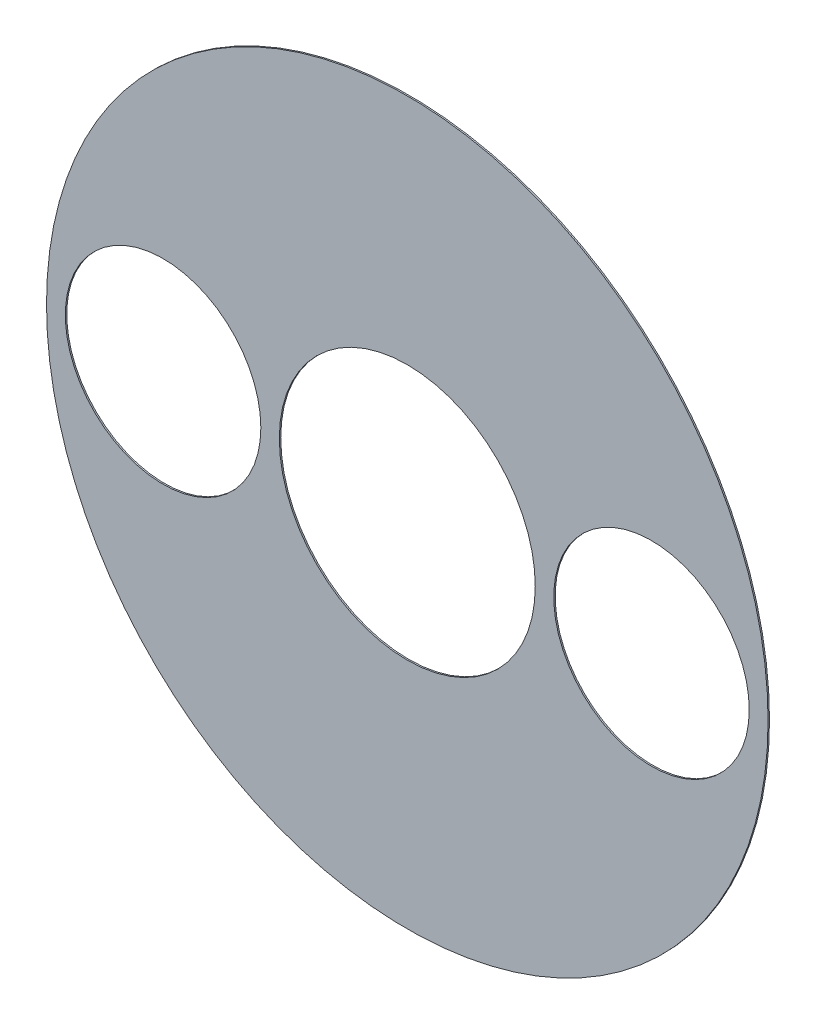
SolidWorks part; units mm, degrees
ref_plane "Front Plane" through (0, 0, 0) normal (0, 0, 1) x (1, 0, 0)
ref_plane "Top Plane" through (0, 0, 0) normal (0, 1, 0) x (1, 0, 0)
ref_plane "Right Plane" through (0, 0, 0) normal (1, 0, 0) x (0, 0, -1)
sketch "Sketch1" plane through (0, 0, 0) normal (0, 0, 1) x (1, 0, 0)
  circle A0 centre (0, 0) radius 507.5
  dimension "Plate dia" = 1015
base flange "Base-Flange1" sketch "Sketch1" thickness 2 reverse thickness direction no parameters "D1"=1
sketch "Sketch6" plane through (0, 0, 0) normal (0, 0, 1) x (1, 0, 0)
  circle A0 centre (0, 0) radius 180
  circle A1 centre (-343.5, 0) radius 137.5
  circle A2 centre (343.5, 0) radius 137.5
  dimension "BH 1" = 360
  dimension "SH 1" = 275
  dimension "SH 2" = 275
  dimension "Hole gap " = 687
  dimension "Hole gap 2" = 343.5
extrude "Cut-Extrude5" cut sketch "Sketch6" against normal blind 10 contours A2 | A0 | A1
sketch "Bend-Lines1" [suppressed] plane through (0, 0, 0) normal (0, 1, 0) x (1, 0, 0)
sketch "Bounding-Box1" [suppressed] plane through (0, 0, 0) normal (0, 1, 0) x (1, 0, 0)
sheet metal parameters "Sheet-Metal1" thickness 2 parameters "D1"=1
flat pattern "Flat-Pattern1"
sketch "Bend-Lines2" plane through (0, 0, 0) normal (0, 1, 0) x (1, 0, 0)
sketch3d "Bounding-Box2" [suppressed]
  line L0 (-507.3263, 507.6734, 0) -> (-507.6735, -507.3261, 0) construction
  line L1 (507.673, 507.3261, 0) -> (507.3258, -507.6734, 0) construction
  line L2 (-507.3263, 507.6734, 0) -> (507.673, 507.3261, 0) construction
  line L3 (-507.6735, -507.3261, 0) -> (507.3258, -507.6734, 0) construction
sheet metal parameters "Sheet-Metal2" thickness 2 parameters "D1"=1
flat pattern "Flat-Pattern1"
sketch "Bend-Lines2" plane through (0, 0, 0) normal (0, 1, 0) x (1, 0, 0)
sketch3d "Bounding-Box2" [suppressed]
  line L0 (507.3263, 507.6734, 0) -> (507.6735, -507.3261, 0) construction
  line L1 (-507.673, 507.3261, 0) -> (-507.3258, -507.6734, 0) construction
  line L2 (507.3263, 507.6734, 0) -> (-507.673, 507.3261, 0) construction
  line L3 (507.6735, -507.3261, 0) -> (-507.3258, -507.6734, 0) construction
equation "\"Plate dia 1\"= 1015"
equation "\"Plate Dia 1.1\"= 1025"
equation "\"Hole Gap 1\"= 687"
equation "\"Hole Gap 1.1\"= 697"
equation "\"Hole Gap 2\"= 343.50"
equation "\"Hole Gap 2.2\"= 353.50"
equation "\"Sh1 1\"= 275"
equation "\"Sh1 1.1\"= 285"
equation "\"Sh2 1\"= 275"
equation "\"Sh2 1.1\"= 285"
equation "\"Bh1 1\"= 360"
equation "\"Bh1 1.1\"= 370"
